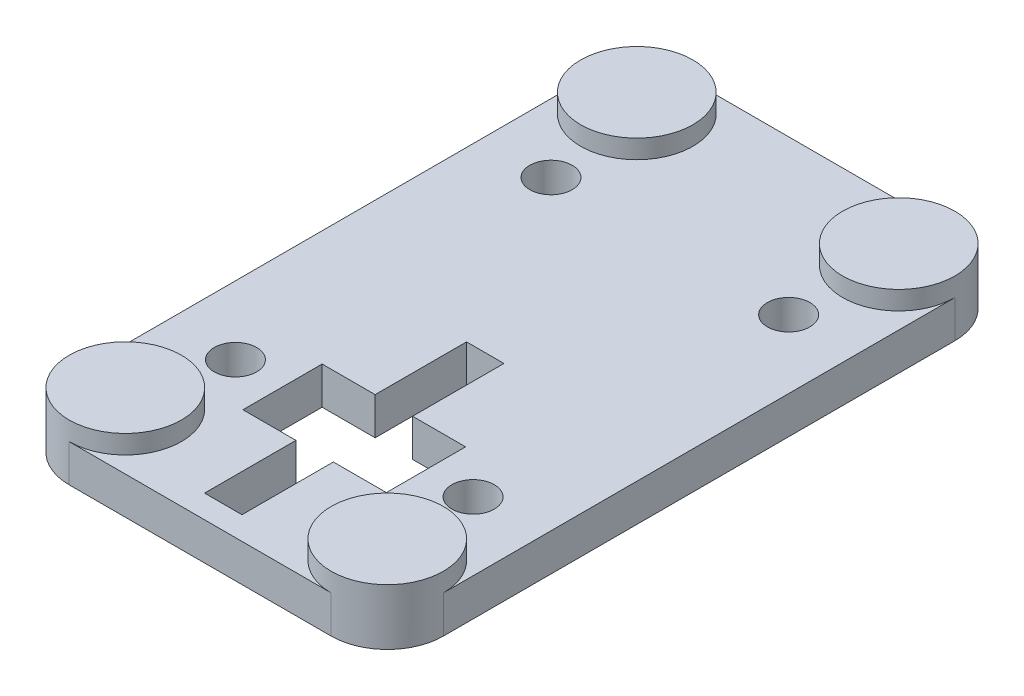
SolidWorks part; units mm, degrees
ref_plane "Alzado" through (0, 0, 0) normal (0, 0, 1) x (1, 0, 0)
ref_plane "Planta" through (0, 0, 0) normal (0, 1, 0) x (1, 0, 0)
ref_plane "Vista lateral" through (0, 0, 0) normal (1, 0, 0) x (0, 0, -1)
sketch "Croquis1" plane through (0, 0, 0) normal (0, 1, 0) x (1, 0, 0)
  line L0 (15, 50) -> (15, 0) construction
  line L1 (30, 0) -> (0, 0)
  line L2 (30, 0) -> (30, 50)
  line L3 (30, 50) -> (0, 50)
  line L4 (0, 0) -> (0, 50)
  line L5 (0, 25) -> (30, 25) construction
  circle A0 centre (25.5, 45.5) radius 3.25
  circle A4 centre (4.5, 45.5) radius 3.25
  circle A5 centre (25.5, 4.5) radius 3.25
  circle A6 centre (4.5, 4.5) radius 3.25
  point P0 (0, 0)
  dimension "D3" = 21
  dimension "D4" = 6.5
  dimension "D5" = 41
  dimension "D1" = 30
  dimension "D2" = 50
extrude "Saliente-Extruir1" add sketch "Croquis1" along normal blind 3
sketch "Croquis2" plane through (0, 3, 0) normal (0, 1, 0) x (1, 0, 0)
  line L0 (30, 50) -> (0, 50) construction
  line L1 (30, 0) -> (30, 50) construction
  line L2 (0, 50) -> (0, 0) construction
  circle A0 centre (4.5, 45.5) radius 4.5
  circle A1 centre (25.5, 45.5) radius 4.5
  circle A2 centre (4.5, 4.5) radius 4.5
  circle A3 centre (25.5, 4.5) radius 4.5
extrude "Saliente-Extruir2" add sketch "Croquis2" along normal blind 1.5
sketch "Croquis4" plane through (0, 3, 0) normal (0, 1, 0) x (1, 0, 0)
  line L0 (4.5, 50) -> (0, 50) construction
  line L1 (0, 50) -> (0, 45.5) construction
  line L2 (30, 50) -> (25.5, 50) construction
  line L3 (30, 45.5) -> (30, 50) construction
  line L4 (30, 0) -> (30, 4.5) construction
  line L5 (25.5, 0) -> (30, 0) construction
  line L6 (0, 0) -> (4.5, 0) construction
  line L7 (0, 4.5) -> (0, 0) construction
  line L8 (4.5, 50) -> (0, 50)
  line L9 (0, 50) -> (0, 45.5)
  line L10 (30, 50) -> (25.5, 50)
  line L11 (30, 45.5) -> (30, 50)
  line L12 (30, 0) -> (30, 4.5)
  line L13 (25.5, 0) -> (30, 0)
  line L14 (0, 0) -> (4.5, 0)
  line L15 (0, 4.5) -> (0, 0)
  arc A0 (4.5, 50) -> (0, 45.5) centre (4.5, 45.5) ccw construction
  arc A1 (30, 45.5) -> (25.5, 50) centre (25.5, 45.5) ccw construction
  arc A2 (25.5, 0) -> (30, 4.5) centre (25.5, 4.5) ccw construction
  arc A3 (0, 4.5) -> (4.5, 0) centre (4.5, 4.5) ccw construction
  arc A4 (4.5, 50) -> (0, 45.5) centre (4.5, 45.5) ccw
  arc A5 (30, 45.5) -> (25.5, 50) centre (25.5, 45.5) ccw
  arc A6 (25.5, 0) -> (30, 4.5) centre (25.5, 4.5) ccw
  arc A7 (0, 4.5) -> (4.5, 0) centre (4.5, 4.5) ccw
extrude "Cortar-Extruir1" cut sketch "Croquis4" against normal through all both and the other way through all
sketch "Croquis5" plane through (0, 0, 0) normal (0, -1, 0) x (1, 0, 0)
  line L1 (20.75, -15.5274) -> (9.25, -15.5274)
  line L2 (20.75, -15.5274) -> (20.75, -9.1774)
  line L3 (20.75, -9.1774) -> (9.25, -9.1774)
  line L4 (9.25, -15.5274) -> (9.25, -9.1774)
extrude "Cortar-Extruir2" cut sketch "Croquis5" against normal through all both and the other way through all
sketch "Croquis6" plane through (0, 3, 0) normal (0, 1, 0) x (1, 0, 0)
  circle A0 centre (24.525, 12.3524) radius 1.7
  circle A1 centre (5.475, 12.3524) radius 1.7
extrude "Cortar-Extruir3" cut sketch "Croquis6" against normal through all both and the other way through all
sketch "Croquis7" plane through (0, 0, 0) normal (0, -1, 0) x (1, 0, 0)
  circle A0 centre (5.475, -37.6476) radius 1.7
  circle A1 centre (24.525, -37.6476) radius 1.7
extrude "Cortar-Extruir4" cut sketch "Croquis7" against normal through all both and the other way through all
sketch "Croquis8" plane through (0, 0, 0) normal (0, -1, 0) x (1, 0, 0)
  line L1 (16.5, -22.8524) -> (13.5, -22.8524)
  line L2 (16.5, -22.8524) -> (16.5, -1.8524)
  line L3 (16.5, -1.8524) -> (13.5, -1.8524)
  line L4 (13.5, -22.8524) -> (13.5, -1.8524)
extrude "Cortar-Extruir5" cut sketch "Croquis8" against normal through all both and the other way through all
